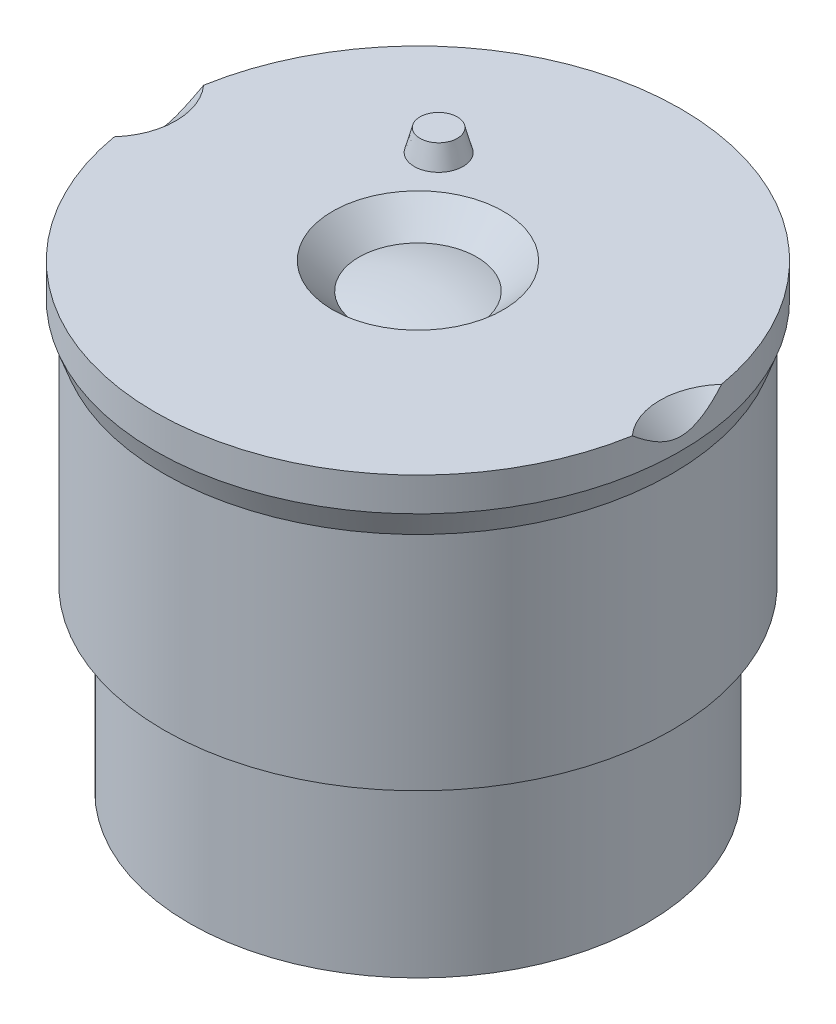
SolidWorks part; units mm, degrees
ref_plane "Front Plane" through (0, 0, 0) normal (0, 0, 1) x (1, 0, 0)
ref_plane "Top Plane" through (0, 0, 0) normal (0, 1, 0) x (1, 0, 0)
ref_plane "Right Plane" through (0, 0, 0) normal (1, 0, 0) x (0, 0, -1)
sketch "Sketch1" plane through (0, 0, 0) normal (0, 0, 1) x (1, 0, 0)
  line L0 (0, 0) -> (0, -20.7988) construction
  line L1 (0, 0) -> (-17, 0)
  line L2 (-17, 0) -> (-17, 13.4)
  line L3 (-17, 13.4) -> (-18.9, 13.4)
  line L4 (-18.9, 13.4) -> (-18.9, 29.9141)
  line L5 (-18.9, 29.9141) -> (-19.55, 31.7)
  line L6 (-19.55, 31.7) -> (-19.55, 34.2)
  line L7 (-19.55, 34.2) -> (-6.35, 34.2)
  line L8 (-6.35, 34.2) -> (-4.3831, 32.2331)
  line L10 (0, 32.8291) -> (0, 0)
  arc A0 (0, 32.8291) -> (-4.3831, 32.2331) centre (0, 16.4146) ccw
  dimension "D1" = 34
  dimension "D2" = 37.8
  dimension "D3" = 39.1
  dimension "D4" = 20
  dimension "D5" = 2.5
  dimension "D6" = 4.2859
  dimension "D7" = 20.8
  dimension "D8" = 34.2
  dimension "D9" = 45
  dimension "D10" = 12.7
revolve "Revolve1" add sketch "Sketch1" angle 360 about L0
sketch "Sketch2" plane through (0, 0, 0) normal (0, 0, 1) x (1, 0, 0)
  line L0 (-23, 35.9199) -> (-23, 26.0968) construction
  line L1 (-23, 34.2) -> (-23, 29.2)
  line L2 (-23, 29.2) -> (-18, 34.2)
  line L3 (19.55, 34.2) -> (-19.55, 34.2) construction
  line L4 (-18, 34.2) -> (-23, 34.2)
  dimension "D1" = 23
  dimension "D2" = 45
  dimension "D3" = 10
revolve "Cut-Revolve1" cut sketch "Sketch2" angle 360 about L0
mirror "Mirror1" about plane through (0, 0, 0) normal (1, 0, 0) of "Cut-Revolve1"
sketch "Sketch3" plane through (0, 34.2, 0) normal (0, 1, 0) x (1, 0, 0)
  circle A0 centre (-6.1925, 7.7319) radius 1.8146
extrude "Boss-Extrude1" add sketch "Sketch3" along normal blind 1.6 draft 15
